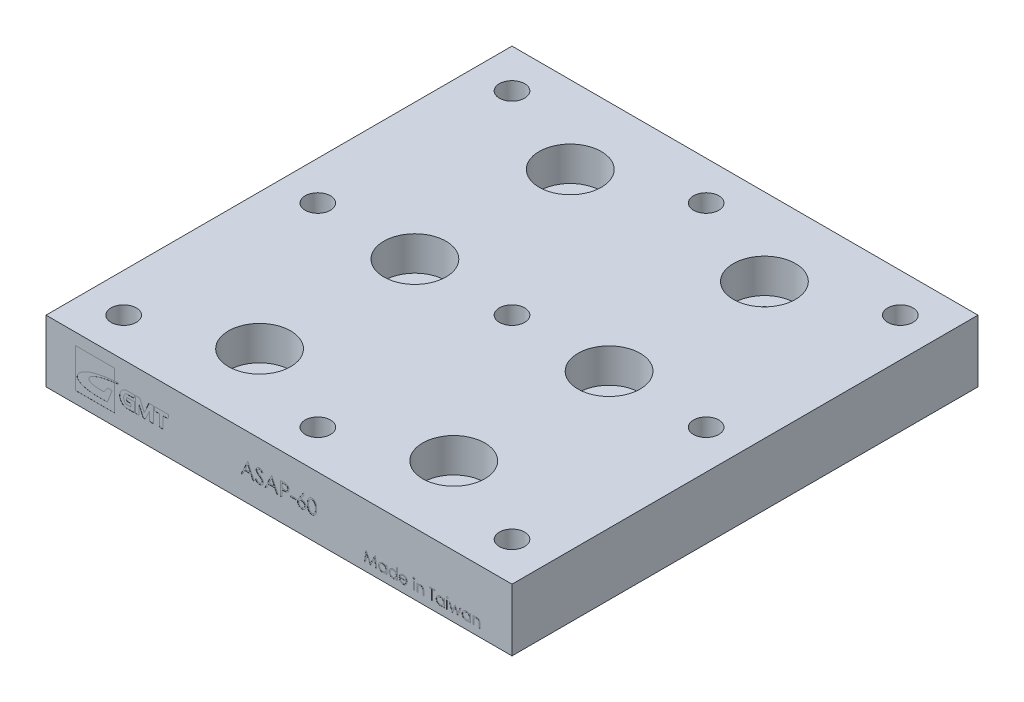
SolidWorks part; units mm, degrees
ref_plane "前基準面" through (0, 0, 0) normal (0, 0, 1) x (1, 0, 0)
ref_plane "上基準面" through (0, 0, 0) normal (0, 1, 0) x (1, 0, 0)
ref_plane "右基準面" through (0, 0, 0) normal (1, 0, 0) x (0, 0, -1)
sketch "草圖1" plane through (0, 0, 0) normal (0, 1, 0) x (1, 0, 0)
  line L1 (-30, -30) -> (30, -30)
  line L2 (-30, -30) -> (-30, 30)
  line L3 (-30, 30) -> (30, 30)
  line L4 (30, -30) -> (30, 30)
  dimension "D1" = 60
  dimension "D2" = 60
  dimension "D3" = 30
  dimension "D4" = 30
extrude "伸長1" add sketch "草圖1" along normal blind 8
ref_plane "平面1" through (0, 8, 0) normal (0, 1, 0) x (-1, 0, 0)
hole_wizard "M4 承窩頭蓋螺釘的柱孔1" positions "草圖3" profile "草圖2" counterbore size "M4" standard "JIS"
sketch "草圖3" plane through (0, 8, 0) normal (0, 1, 0) x (-1, 0, 0)
  point P0 (12.5, 20)
  dimension "D1" = 20
  dimension "D2" = 12.5
sketch "草圖2" plane through (-12.5, 8, 20) normal (1, 0, 0) x (0, 0, 1)
  line L0 (0, 0) -> (0, 8)
  line L1 (0, 8) -> (2.25, 8)
  line L3 (2.25, 8) -> (2.25, 4.4)
  line L4 (2.25, 4.4) -> (4, 4.4)
  line L5 (4, 4.4) -> (4, 0)
  line L7 (4, 0) -> (0, 0)
  line L11 (0, -6.35) -> (0, 107.95) construction
  dimension "貫穿孔直徑" = 4.5
  dimension "貫穿孔深度" = 8
  dimension "柱孔直徑" = 8
  dimension "柱孔深度" = 4.4
pattern_linear "直線複製排列1" count 2 spacing 25 along (1, 0, 0) count 3 spacing 20 along (0, 0, -1) of "M4 承窩頭蓋螺釘的柱孔1"
hole_wizard "M4x0.7 螺紋孔1" positions "草圖5" profile "草圖4" tap size "M4x0.7" standard "JIS"
sketch "草圖5" plane through (0, 8, 0) normal (0, 1, 0) x (-1, 0, 0)
  point P0 (25, 25)
  dimension "D1" = 25
  dimension "D2" = 25
sketch "草圖4" plane through (-25, 8, 25) normal (1, 0, 0) x (0, 0, 1)
  line L0 (0, 0) -> (0, 8)
  line L1 (0, 8) -> (1.625, 8)
  line L2 (1.625, 8) -> (1.625, 0)
  line L5 (1.625, 0) -> (0, 0)
  line L11 (0, -6.35) -> (0, 107.95) construction
  dimension "貫穿螺孔鑽直徑" = 3.25
  dimension "貫穿螺孔鑽深度" = 8
pattern_linear "直線複製排列2" count 3 spacing 25 along (1, 0, 0) count 3 spacing 25 along (0, 0, -1) of "M4x0.7 螺紋孔1"
ref_plane "平面2" through (0, 0, 30) normal (0, 0, 1) x (1, 0, 0)
sketch "草圖6" plane through (0, 0, 30) normal (0, 0, 1) x (1, 0, 0)
  line L0 (-26.2, 6.5036) -> (-26.2, 1.5)
  line L1 (-26.2, 1.5) -> (-21.2015, 1.5)
  line L2 (-21.2015, 1.5) -> (-21.2015, 6.5036)
  line L3 (-26.2, 6.5036) -> (-21.2015, 6.5036)
  line L4 (-30, 0) -> (30, 0) construction
  line L5 (30, 8) -> (30, 0) construction
  dimension "D1" = 4.9985
  dimension "D2" = 5.0036
  dimension "D3" = 1.5
  dimension "D4" = 56.2
extrude "除料-伸長1" cut sketch "草圖6" against normal blind 0.01
sketch "草圖7" plane through (0, 0, 30) normal (0, 0, 1) x (1, 0, 0)
  line L0 (-26.2128, 6.5165) -> (-26.2128, 1.5128)
  line L1 (-26.2128, 1.5128) -> (-21.2143, 1.5128)
  line L2 (-21.2143, 1.5128) -> (-21.2143, 4.8811)
  line L3 (-21.2143, 5.0353) -> (-21.2143, 6.5165)
  line L4 (-14.904, 4.2857) -> (-14.904, 2.7967)
  line L5 (-14.904, 4.2857) -> (-14.4056, 4.2857)
  line L6 (-14.2493, 4.442) -> (-14.2493, 4.7906)
  line L7 (-14.2493, 4.7906) -> (-16.0546, 4.7906)
  line L8 (-16.0546, 4.7906) -> (-16.0546, 4.2951)
  line L9 (-16.0546, 4.2951) -> (-15.4083, 4.2951)
  line L10 (-15.4083, 4.2951) -> (-15.4083, 2.9558)
  line L11 (-15.2533, 2.7995) -> (-14.904, 2.7967)
  line L12 (-16.1901, 4.7906) -> (-16.7558, 4.7906)
  line L13 (-17.9247, 4.7906) -> (-18.4897, 4.7906)
  line L14 (-18.6196, 4.7906) -> (-19.6732, 4.7906)
  line L15 (-18.4897, 4.7906) -> (-18.4897, 2.8007)
  line L16 (-16.1908, 2.8007) -> (-16.5267, 2.8007)
  line L17 (-17.1941, 2.8007) -> (-17.4864, 2.8007)
  line L18 (-18.1538, 2.8007) -> (-18.4897, 2.8007)
  line L19 (-18.6305, 2.8007) -> (-19.6732, 2.8007)
  line L20 (-17.9247, 4.7906) -> (-17.3402, 3.4355)
  line L21 (-17.9974, 3.9578) -> (-17.9974, 2.9571)
  line L22 (-17.9974, 2.9571) -> (-17.9974, 3.9578)
  line L23 (-17.9974, 3.9578) -> (-17.4864, 2.8007)
  line L24 (-16.1908, 4.7906) -> (-16.1908, 2.8007)
  line L25 (-16.683, 3.9578) -> (-16.683, 2.9571)
  line L26 (-16.683, 2.9571) -> (-16.683, 3.9578)
  line L27 (-16.683, 3.9578) -> (-17.1941, 2.8007)
  line L28 (-16.7558, 4.7906) -> (-17.3402, 3.4355)
  line L29 (-18.6305, 4.0261) -> (-19.636, 4.0261)
  line L30 (-18.6305, 4.0261) -> (-18.6305, 2.8007)
  line L31 (-19.636, 4.0261) -> (-19.636, 3.758)
  line L32 (-19.0634, 3.6016) -> (-19.4796, 3.6016)
  line L33 (-19.0634, 3.6016) -> (-19.0634, 3.221)
  line L34 (-19.0634, 3.221) -> (-19.6732, 3.221)
  line L35 (-18.6196, 4.7906) -> (-18.6196, 4.542)
  line L36 (-19.6732, 4.3856) -> (-18.776, 4.3856)
  line L37 (-22.1168, 2.2449) -> (-21.4907, 3.8355)
  line L38 (-21.4907, 3.8355) -> (-22.0548, 3.835)
  line L39 (-22.0548, 3.835) -> (-22.5834, 3.1556)
  line L40 (-20.669, 5.0915) -> (-20.669, 4.947)
  line L41 (-22.1168, 2.2449) -> (-23.5982, 2.2368)
  line L42 (-26.2128, 6.5165) -> (-21.2143, 6.5165)
  arc A0 (-14.4056, 4.2857) -> (-14.2493, 4.442) centre (-14.4056, 4.442) ccw
  arc A1 (-15.4083, 2.9558) -> (-15.2533, 2.7995) centre (-15.252, 2.9558) ccw
  arc A2 (-18.1538, 2.8007) -> (-17.9974, 2.9571) centre (-18.1538, 2.9571) ccw
  arc A3 (-16.683, 2.9571) -> (-16.5267, 2.8007) centre (-16.5267, 2.9571) ccw
  arc A4 (-19.636, 3.758) -> (-19.4796, 3.6016) centre (-19.4796, 3.758) ccw
  arc A5 (-18.776, 4.3856) -> (-18.6196, 4.542) centre (-18.776, 4.542) ccw
  arc A6 (-19.6732, 4.3856) -> (-19.6732, 3.221) centre (-19.3099, 3.8033) ccw
  arc A7 (-19.6732, 4.7906) -> (-19.6732, 2.8007) centre (-19.5033, 3.7957) ccw
  arc A8 (-23.3183, 3.183) -> (-22.5834, 3.1556) centre (-22.6614, 10.927) ccw
  arc A9 (-23.9198, 3.2632) -> (-23.3183, 3.183) centre (-23.2894, 5.6964) ccw
  arc A10 (-24.3876, 3.4547) -> (-23.9198, 3.2632) centre (-23.6946, 4.4803) ccw
  arc A11 (-24.5053, 3.6591) -> (-24.3876, 3.4547) centre (-24.2704, 3.6583) ccw
  arc A12 (-24.4311, 3.828) -> (-24.5053, 3.6591) centre (-24.1843, 3.6188) ccw
  arc A13 (-24.1794, 4.0514) -> (-24.4311, 3.828) centre (-23.6157, 3.1627) ccw
  arc A14 (-23.8394, 4.2366) -> (-24.1794, 4.0514) centre (-22.733, 1.8003) ccw
  arc A15 (-23.8394, 4.2366) -> (-23.4173, 4.403) centre (-27.0446, 12.984) ccw
  arc A16 (-23.4173, 4.403) -> (-23.0391, 4.5159) centre (-32.3382, 34.9901) ccw
  arc A17 (-22.6639, 4.6143) -> (-23.0391, 4.5159) centre (-22.3221, 2.5477) ccw
  arc A18 (-22.6639, 4.6143) -> (-22.3497, 4.6799) centre (-23.0321, 7.1622) ccw
  arc A19 (-21.9478, 4.7576) -> (-22.3497, 4.6799) centre (-19.8319, -7.2747) ccw
  arc A20 (-21.9478, 4.7576) -> (-21.5679, 4.8255) centre (-22.3094, 7.8739) ccw
  arc A21 (-21.5679, 4.8255) -> (-21.2303, 4.8771) centre (-21.6974, 6.8043) ccw
  arc A22 (-20.921, 4.9198) -> (-21.2303, 4.8771) centre (-17.6119, -20.1977) ccw
  arc A23 (-20.669, 4.947) -> (-20.921, 4.9198) centre (-20.602, 3.1447) ccw
  arc A24 (-23.5982, 2.2368) -> (-24.095, 2.2805) centre (-28.0059, -45.0151) ccw
  arc A25 (-24.6491, 2.3513) -> (-24.095, 2.2805) centre (-23.36, 10.242) ccw
  arc A26 (-25.3783, 2.5395) -> (-24.6491, 2.3513) centre (-23.8432, 6.98) ccw
  arc A27 (-25.8705, 2.8558) -> (-25.3783, 2.5395) centre (-24.8096, 3.9657) ccw
  arc A28 (-25.9971, 3.1546) -> (-25.8705, 2.8558) centre (-25.6002, 3.1465) ccw
  arc A29 (-25.8354, 3.5447) -> (-25.9971, 3.1546) centre (-25.3155, 3.1006) ccw
  arc A30 (-25.4556, 3.9172) -> (-25.8354, 3.5447) centre (-24.2434, 2.3018) ccw
  arc A31 (-24.9986, 4.1773) -> (-25.4556, 3.9172) centre (-22.4314, -0.866) ccw
  arc A32 (-24.5624, 4.375) -> (-24.9986, 4.1773) centre (-22.694, -0.3273) ccw
  arc A33 (-24.2491, 4.4858) -> (-24.5624, 4.375) centre (-1.7524, -59.6229) ccw
  arc A34 (-23.8091, 4.6128) -> (-24.2491, 4.4858) centre (-22.8782, 0.5616) ccw
  arc A35 (-23.3458, 4.7301) -> (-23.8091, 4.6128) centre (-22.0077, -1.5273) ccw
  arc A36 (-22.9116, 4.814) -> (-23.3458, 4.7301) centre (-20.6114, -8.2545) ccw
  arc A37 (-22.9116, 4.814) -> (-22.5352, 4.8854) centre (-23.434, 8.5979) ccw
  arc A38 (-22.1978, 4.933) -> (-22.5352, 4.8854) centre (-22.0986, 3.0087) ccw
  arc A39 (-21.8045, 4.9793) -> (-22.1978, 4.933) centre (-21.649, 1.9691) ccw
  arc A40 (-21.4555, 5.0244) -> (-21.8045, 4.9793) centre (-21.1753, 1.4821) ccw
  arc A41 (-21.1343, 5.0559) -> (-21.4555, 5.0244) centre (-20.519, -2.8822) ccw
  arc A42 (-21.3168, 5.0396) -> (-20.9039, 5.0782) centre (-23.5984, 31.6781) ccw
  arc A43 (-20.669, 5.0915) -> (-20.9039, 5.0782) centre (-20.6948, 3.4685) ccw
extrude "除料-伸長2" cut sketch "草圖7" against normal blind 0.02
sketch "草圖8" plane through (0, 0, 30) normal (0, 0, 1) x (1, 0, 0)
  line L0 (0, 12.3095) -> (0, -1.1398) construction
  line L1 (-30, 0) -> (30, 0) construction
  line L2 (6.5009, 2.9) -> (-6.5009, 2.9) construction
  text T0 "ASAP-60" font "Century Gothic" height in points 5
  dimension "D1" = 2.9
extrude "除料-伸長3" cut sketch "草圖8" against normal blind 0.02
sketch "草圖11"
  dimension "D2" = 1
extrude "除料-伸長5" cut sketch "草圖11" against normal blind 0.01
